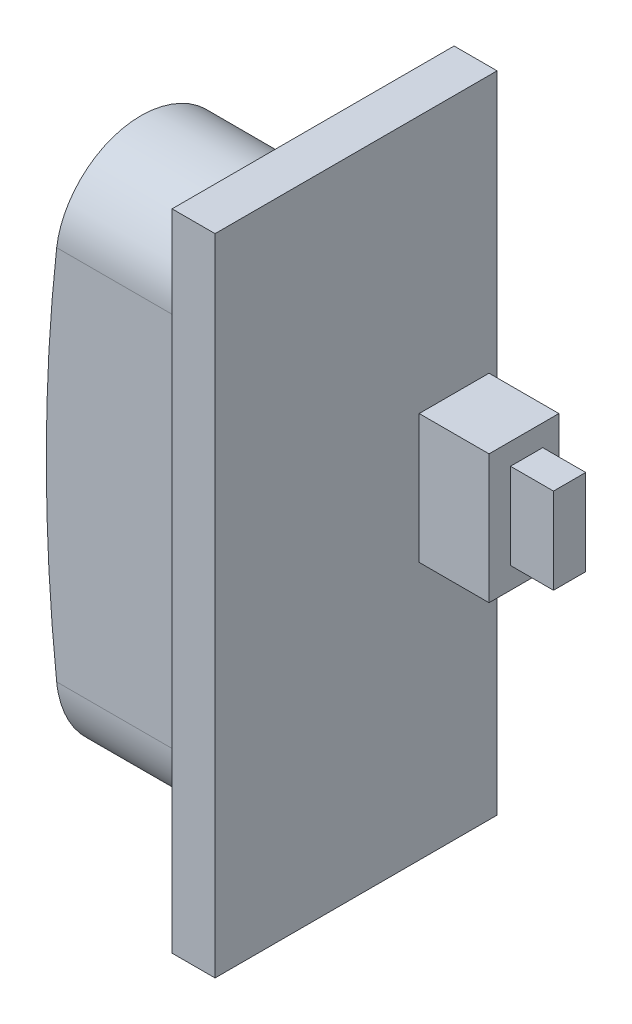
SolidWorks part; units mm, degrees
ref_plane "前视基准面" through (0, 0, 0) normal (0, 0, 1) x (1, 0, 0)
ref_plane "上视基准面" through (0, 0, 0) normal (0, 1, 0) x (1, 0, 0)
ref_plane "右视基准面" through (0, 0, 0) normal (1, 0, 0) x (0, 0, -1)
other "Configuration Table"
sketch "Button_captive_flange_light_baffle_Sketch" plane through (0, 0, 0) normal (0, 0, 1) x (1, 0, 0)
  line L1 (-28.6, -6) -> (-27.8, -6)
  line L2 (-28.6, -6) -> (-28.6, 6)
  line L3 (-28.6, 6) -> (-27.8, 6)
  line L4 (-27.8, -6) -> (-27.8, 6)
extrude "Button_captive_flange_light_baffle" add sketch "Button_captive_flange_light_baffle_Sketch" along normal blind 5.25 from offset 3.55
sketch "Capsule_press_face_10x3_R1_5_Sketch" plane through (0, 0, 0) normal (1, 0, 0) x (0, 0, -1)
  line L0 (-5, -3.5) -> (-5, 3.5)
  line L1 (-8, 3.5) -> (-8, -3.5)
  arc A0 (-5, 3.5) -> (-6.5, 5) centre (-6.5, 3.5) ccw
  arc A1 (-6.5, 5) -> (-8, 3.5) centre (-6.5, 3.5) ccw
  arc A2 (-8, -3.5) -> (-6.5, -5) centre (-6.5, -3.5) ccw
  arc A3 (-6.5, -5) -> (-5, -3.5) centre (-6.5, -3.5) ccw
extrude "Capsule_press_face_10x3_R1_5" add sketch "Capsule_press_face_10x3_R1_5_Sketch" along normal blind 5.8 from offset 34
sketch "Button_stem_root_Sketch" plane through (0, 0, 0) normal (0, 0, 1) x (1, 0, 0)
  line L1 (-27.8, -1.2) -> (-26.5, -1.2)
  line L2 (-27.8, -1.2) -> (-27.8, 1.2)
  line L3 (-27.8, 1.2) -> (-26.5, 1.2)
  line L4 (-26.5, -1.2) -> (-26.5, 1.2)
extrude "Button_stem_root" add sketch "Button_stem_root_Sketch" along normal blind 1.3 from offset 3.7
sketch "SW1_contact_tip_nominal_gap0_35_Sketch" plane through (0, 0, 0) normal (0, 0, 1) x (1, 0, 0)
  line L1 (-26.5, -0.8) -> (-25.7, -0.8)
  line L2 (-26.5, -0.8) -> (-26.5, 0.8)
  line L3 (-26.5, 0.8) -> (-25.7, 0.8)
  line L4 (-25.7, -0.8) -> (-25.7, 0.8)
extrude "SW1_contact_tip_nominal_gap0_35" add sketch "SW1_contact_tip_nominal_gap0_35_Sketch" along normal blind 0.6 from offset 4
sketch "Face_surface_projection0_8_section" plane through (0, 0, 0) normal (0, 1, 0) x (1, 0, 0)
  line L0 (28.2061, 0) -> (40, 0)
  line L1 (40, 0) -> (40, -13.7)
  line L2 (40, -13.7) -> (28.6, -13.7)
  line L3 (0, 0) -> (0, -20) construction
  arc A0 (28.6, -13.7) -> (28.2061, 0) centre (23.1859, -7) ccw
revolve "Curved_face_projection0_8" cut sketch "Face_surface_projection0_8_section" angle 360 about L3
